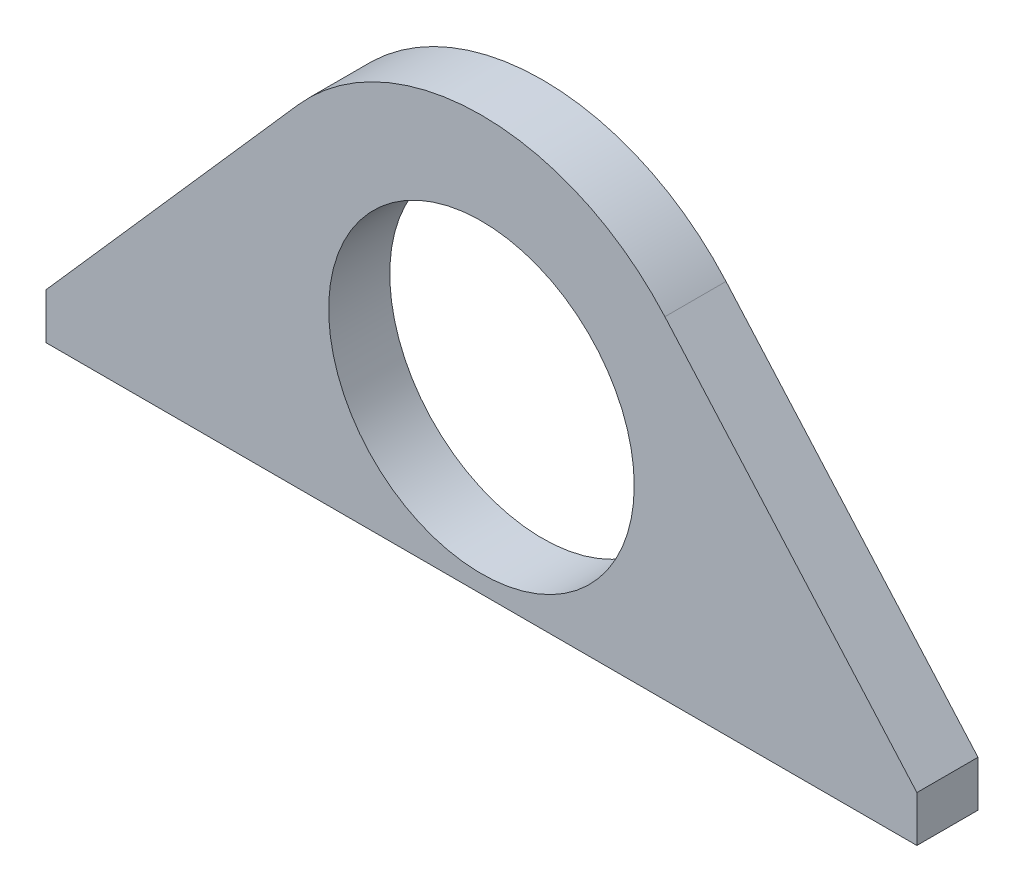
SolidWorks part; units mm, degrees
ref_plane "Plan de face" through (0, 0, 0) normal (0, 0, 1) x (1, 0, 0)
ref_plane "Plan de dessus" through (0, 0, 0) normal (0, 1, 0) x (1, 0, 0)
ref_plane "Plan de droite" through (0, 0, 0) normal (1, 0, 0) x (0, 0, -1)
sketch "Esquisse1" plane through (0, 0, 0) normal (0, 0, 1) x (1, 0, 0)
  line L0 (-57, -22.3) -> (-57, -16.3)
  line L1 (-57, -16.3) -> (-24.0133, 21.1509)
  line L2 (0, 32) -> (0, -22.3) construction
  line L3 (57, -22.3) -> (-57, -22.3)
  line L4 (57, -16.3) -> (24.0133, 21.1509)
  line L5 (57, -22.3) -> (57, -16.3)
  circle A0 centre (0, 0) radius 20
  arc A1 (-24.0133, 21.1509) -> (0, 32) centre (0, 0) cw
  arc A2 (24.0133, 21.1509) -> (0, 32) centre (0, 0) ccw
  dimension "D2" = 32
  dimension "D3" = 40
  dimension "D1" = 114
  dimension "D4" = 6
  dimension "D5" = 22.3
extrude "Extrusion1" add sketch "Esquisse1" along normal blind 8
